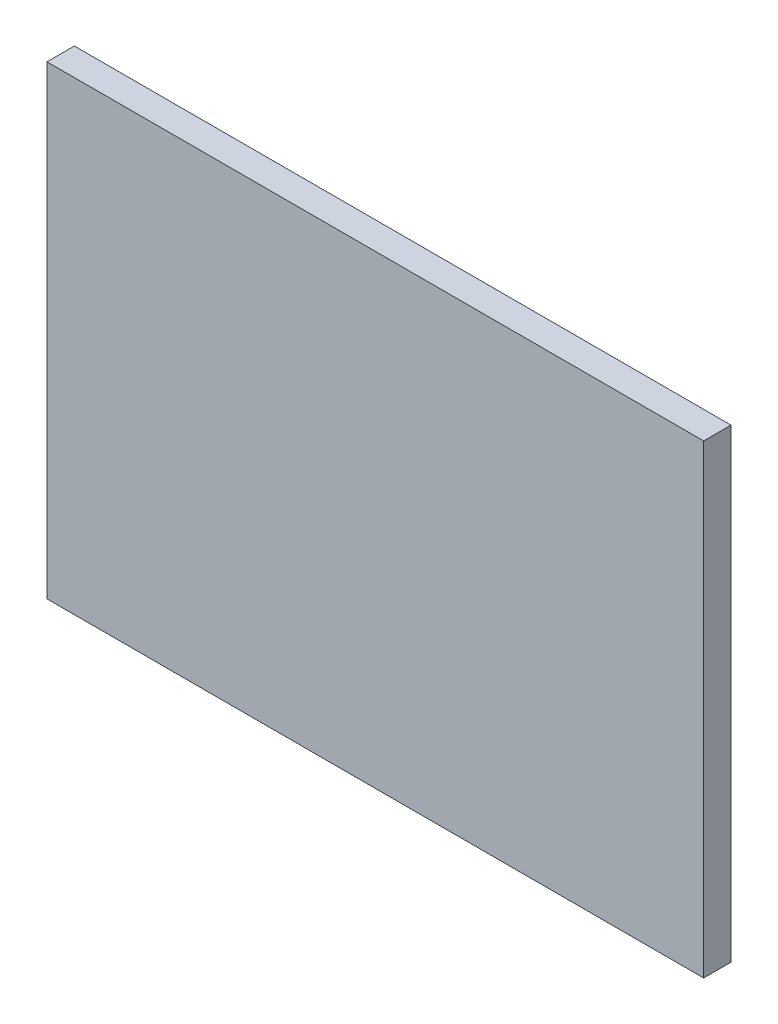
SolidWorks part; units mm, degrees
ref_plane "前视基准面" through (0, 0, 0) normal (0, 0, 1) x (1, 0, 0)
ref_plane "上视基准面" through (0, 0, 0) normal (0, 1, 0) x (1, 0, 0)
ref_plane "右视基准面" through (0, 0, 0) normal (1, 0, 0) x (0, 0, -1)
other "Configuration Table"
sketch "草图1" plane through (0, 0, 0) normal (0, 0, 1) x (1, 0, 0)
  line L1 (60, -42.5) -> (-60, -42.5)
  line L2 (60, -42.5) -> (60, 42.5)
  line L3 (60, 42.5) -> (-60, 42.5)
  line L4 (-60, -42.5) -> (-60, 42.5)
  line L5 (60, -42.5) -> (-60, 42.5) construction
  line L6 (60, 42.5) -> (-60, -42.5) construction
  point P0 (0, 0)
  dimension "D1" = 120
  dimension "D2" = 85
extrude "凸台-拉伸1" add sketch "草图1" along normal blind 5
